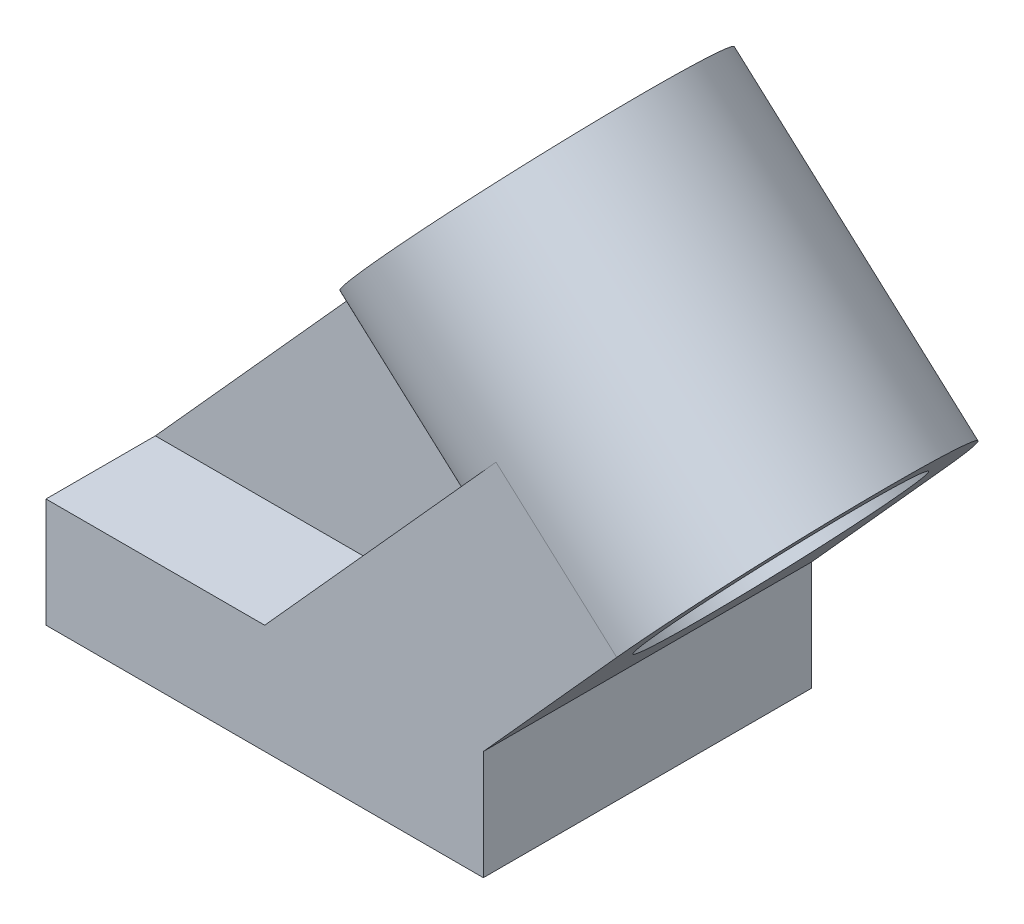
SolidWorks part; units mm, degrees
ref_plane "Front" through (0, 0, 0) normal (0, 0, 1) x (1, 0, 0)
ref_plane "Top" through (0, 0, 0) normal (0, 1, 0) x (1, 0, 0)
ref_plane "Right" through (0, 0, 0) normal (1, 0, 0) x (0, 0, -1)
sketch "Sketch1" plane through (0, 0, 0) normal (0, 0, 1) x (1, 0, 0)
  line L0 (0, 0) -> (101.6, 0)
  line L1 (101.6, 0) -> (101.6, 25.4)
  line L2 (101.6, 25.4) -> (132.5917, 59.8197)
  line L3 (132.5917, 59.8197) -> (104.5367, 85.0806)
  line L4 (104.5367, 85.0806) -> (50.8, 25.4)
  line L5 (50.8, 25.4) -> (0, 25.4)
  line L6 (0, 25.4) -> (0, 0)
  dimension "D1" = 25.4
  dimension "D2" = 50.8
  dimension "D3" = 101.6
  dimension "D4" = 48
  dimension "D5" = 114.3
extrude "Boss-Extrude1" add sketch "Sketch1" along normal blind 76.2
sketch "Sketch2" plane through (43.4796, -39.1492, 0) normal (0.7431, -0.6691, 0) x (0, 0, -1)
  line L0 (-76.2, 133.1759) -> (0, 133.1759) construction
  circle A0 centre (-38.1, 133.1759) radius 38.1
extrude "Boss-Extrude2" add sketch "Sketch2" against normal blind 76.2
sketch "Sketch3" plane through (-13.148, 11.8385, 0) normal (-0.7431, 0.6691, 0) x (0, 0, 1)
  circle A0 centre (38.1, 133.1759) radius 28.575
  dimension "D1" = 57.15
extrude "Cut-Extrude1" cut sketch "Sketch3" against normal through all
ref_plane "Plane1" through (0, 0, 38.1) normal (0, 0, 1) x (1, 0, 0)
sketch "Sketch4" plane through (0, 0, 38.1) normal (0, 0, 1) x (1, 0, 0)
  line L0 (0, 25.4) -> (50.9878, 82.0276)
  line L1 (50.4702, 82.4937) -> (79.0428, 56.7668) construction
  line L2 (104.5367, 85.0806) -> (50.8, 25.4) construction
rib "Rib1" sketch "Sketch4" sketch "Sketch4" thickness 25.4 extrusion direction parallel to sketch draft on no parameters "D1"=25.4
